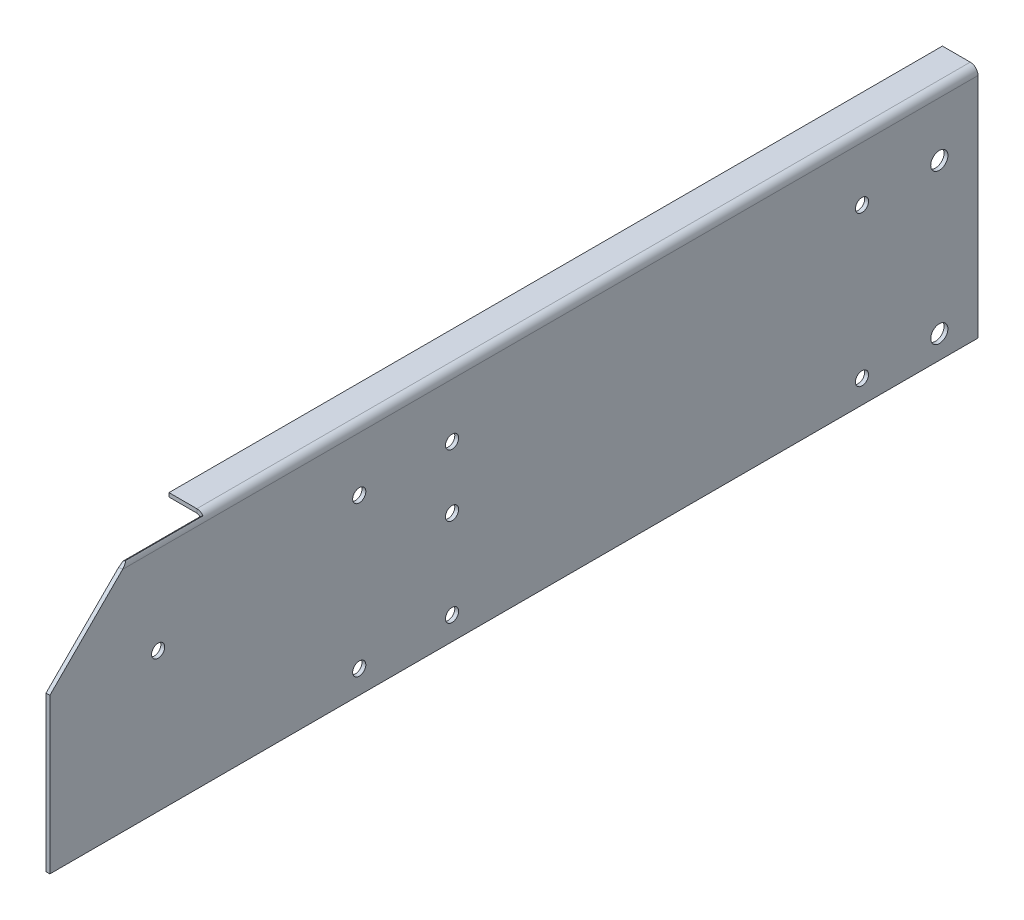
SolidWorks part; units mm, degrees
other "<CP035781>-<Dégagement M81>"
ref_plane "Plan de face" through (0, 0, 0) normal (0, 0, 1) x (1, 0, 0)
ref_plane "Plan de dessus" through (0, 0, 0) normal (0, 1, 0) x (1, 0, 0)
ref_plane "Plan de droite" through (0, 0, 0) normal (1, 0, 0) x (0, 0, -1)
mirrored part "CP035781_Rendre symétrique"
